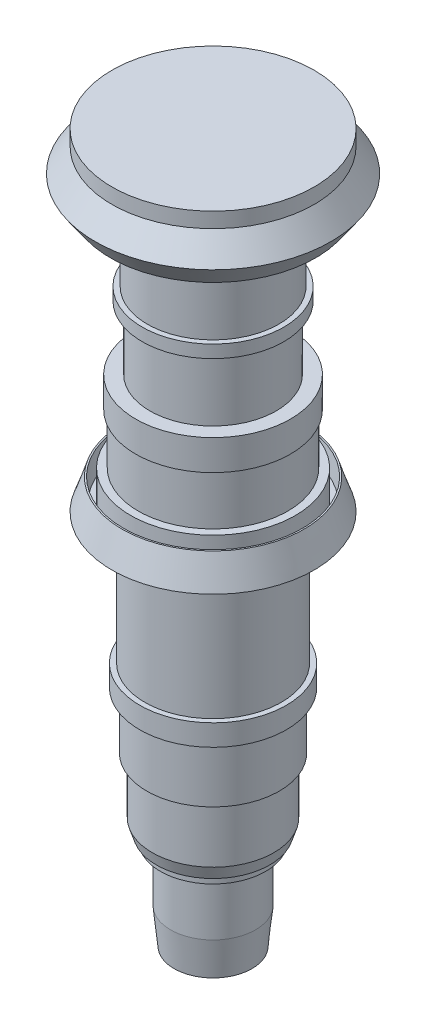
SolidWorks part; units mm, degrees
ref_plane "前视基准面" through (0, 0, 0) normal (0, 0, 1) x (1, 0, 0)
ref_plane "上视基准面" through (0, 0, 0) normal (0, 1, 0) x (1, 0, 0)
ref_plane "右视基准面" through (0, 0, 0) normal (1, 0, 0) x (0, 0, -1)
other "Configuration Table"
sketch "草图1" plane through (0, 0, 0) normal (0, 0, 1) x (1, 0, 0)
  line L0 (0, 0) -> (0, 1400)
  line L1 (0, 1400) -> (200, 1400)
  line L2 (200, 1400) -> (200, 1370)
  line L3 (200, 1370) -> (233, 1322.8711)
  line L4 (233, 1322.8711) -> (202.9813, 1280)
  line L5 (202.9813, 1280) -> (188, 1280)
  line L6 (188, 1280) -> (188, 1340)
  line L7 (188, 1340) -> (146, 1340)
  line L8 (146, 1340) -> (146, 1280)
  line L9 (146, 1280) -> (130, 1280)
  line L10 (130, 1280) -> (130, 1130)
  line L11 (130, 1130) -> (140, 1130)
  line L12 (140, 1130) -> (140, 1105)
  line L13 (140, 1105) -> (125, 1105)
  line L14 (125, 1105) -> (125, 979)
  line L15 (125, 979) -> (153, 979)
  line L16 (153, 979) -> (153, 919)
  line L17 (153, 919) -> (148, 919)
  line L18 (148, 919) -> (148, 819)
  line L19 (148, 819) -> (163, 819)
  line L20 (163, 819) -> (163, 759)
  line L21 (163, 759) -> (175, 759)
  line L26 (175, 759) -> (177, 804)
  line L27 (177, 804) -> (180, 804)
  line L28 (180, 804) -> (200, 744)
  line L31 (191, 755) -> (135, 755)
  line L32 (135, 755) -> (135, 485)
  line L33 (135, 485) -> (145, 485)
  line L34 (145, 485) -> (145, 443)
  line L35 (145, 443) -> (131, 443)
  line L36 (131, 443) -> (131, 331)
  line L37 (131, 331) -> (120, 331)
  line L42 (84, 70) -> (77, 0)
  line L43 (77, 0) -> (0, 0)
  line L44 (200, 744) -> (197, 744)
  line L45 (197, 744) -> (191, 755)
  line L46 (84, 70) -> (84, 180)
  line L47 (84, 180) -> (104, 180)
  line L48 (104, 180) -> (104, 195)
  line L49 (104, 195) -> (112, 195)
  line L50 (112, 195) -> (120, 220)
  line L51 (120, 220) -> (120, 331)
  point P27 (153, 331)
  point P39 (84, 70)
  point P42 (95.8695, 18.2357)
  point P43 (84, 68.9813)
  point P44 (0, 0)
  dimension "D1" = 200
  dimension "D2" = 30
  dimension "D3" = 1400
  dimension "D4" = 120
  dimension "D5" = 233
  dimension "D6" = 146
  dimension "D7" = 55
  dimension "D8" = 55
  dimension "D9" = 42
  dimension "D10" = 60
  dimension "D11" = 120
  dimension "D12" = 130
  dimension "D13" = 150
  dimension "D14" = 10
  dimension "D15" = 25
  dimension "D16" = 15
  dimension "D17" = 126
  dimension "D18" = 28
  dimension "D19" = 5
  dimension "D20" = 100
  dimension "D21" = 15
  dimension "D22" = 60
  dimension "D23" = 180
  dimension "D24" = 200
  dimension "D25" = 3
  dimension "D26" = 3
  dimension "D27" = 60
  dimension "D28" = 12
  dimension "D29" = 60
  dimension "D30" = 45
  dimension "D31" = 11
  dimension "D32" = 56
  dimension "D33" = 270
  dimension "D34" = 135
  dimension "D35" = 145
  dimension "D36" = 14
  dimension "D37" = 42
  dimension "D38" = 112
  dimension "D39" = 77
  dimension "D40" = 84
  dimension "D41" = 70
  dimension "D42" = 180
  dimension "D43" = 20
  dimension "D44" = 15
  dimension "D45" = 120
  dimension "D46" = 112
  dimension "D47" = 25
revolve "旋转1" add sketch "草图1" angle 360 about L0
sketch "草图2" plane through (0, 0, 0) normal (0, -1, 0) x (1, 0, 0)
  circle A0 centre (0, 0) radius 70
extrude "切除-拉伸1" cut sketch "草图2" against normal blind 420
